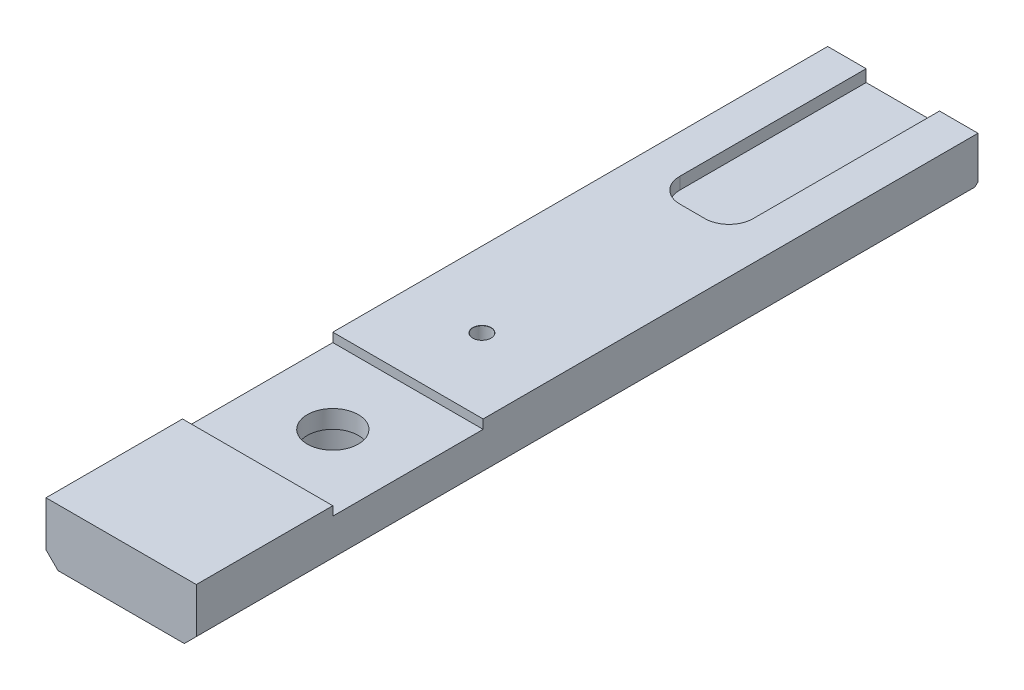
SolidWorks part; units mm, degrees
ref_plane "Plan1" through (0, 0, 0) normal (0, 0, 1) x (1, 0, 0)
ref_plane "Plan2" through (0, 0, 0) normal (0, 1, 0) x (1, 0, 0)
ref_plane "Plan3" through (0, 0, 0) normal (1, 0, 0) x (0, 0, -1)
sketch "Esquisse1" plane through (0, 0, 0) normal (0, 0, 1) x (1, 0, 0)
  line L0 (-12.5, 0) -> (-6.1, 0)
  line L1 (-6.1, 0) -> (-6.1, 1.5)
  line L2 (-6.1, 1.5) -> (6.1, 1.5)
  line L3 (6.1, 1.5) -> (6.1, 0)
  line L4 (6.1, 0) -> (12.5, 0)
  line L5 (-12.5, 0) -> (-12.5, 11.5)
  line L6 (-12.5, 11.5) -> (12.5, 11.5)
  line L7 (12.5, 11.5) -> (12.5, 0)
  line L8 (0, 21.0228) -> (0, -6.5728) construction
  dimension "D1" = 12.2
  dimension "D4" = 25
  dimension "D5" = 1.5
  dimension "D6" = 11.5
extrude "Base-Extrusion" add sketch "Esquisse1" along normal blind 130
chamfer "Chanfrein1" distance 0.5 angle 45 2 edges at (-6.1, 0, 65) (6.1, 0, 65)
sketch "Esquisse2" plane through (12.5, 0, 0) normal (1, 0, 0) x (0, 0, -1)
  line L0 (-130, 2) -> (-128, 0)
  line L1 (0, 4.5) -> (-4.5, 0)
  line L2 (-130, 0) -> (0, 0) construction
  line L3 (-130, 0) -> (-128, 0)
  line L4 (0, 0) -> (0, 11.5) construction
  line L5 (0, 0) -> (0, 4.5)
  line L6 (-130, 0) -> (-130, 11.5) construction
  line L7 (-130, 0) -> (-130, 2)
  line L8 (-4.5, 0) -> (0, 0)
  line L9 (-130, 11.5) -> (0, 11.5) construction
  line L10 (-107.3, 11.5) -> (-82.3, 11.5)
  line L11 (-107.3, 11.5) -> (-107.3, 10)
  line L12 (-107.3, 10) -> (-82.3, 10)
  line L13 (-82.3, 10) -> (-82.3, 11.5)
  line L14 (-94.8, 21.0588) -> (-94.8, 4.5) construction
  dimension "D1" = 4.5
  dimension "D2" = 2
  dimension "D3" = 2
  dimension "D4" = 25
  dimension "D5" = 1.5
  dimension "D6" = 35.2
extrude "Enlèv. mat.-Extru.1" cut sketch "Esquisse2" against normal through all
sketch "Esquisse5" plane through (0, 10, 0) normal (0, 1, 0) x (-1, 0, 0)
  line L0 (12.5, 107.3) -> (-12.5, 82.3) construction
  line L1 (-12.5, 130) -> (12.5, 130) construction
  line L2 (0, 130) -> (0, 58.7426) construction
  circle A0 centre (0, 94.8) radius 4.25
  dimension "D1" = 8.5
extrude "Enlèv. mat.-Extru.2" cut sketch "Esquisse5" against normal through all
sketch "Esquisse6" plane through (0, 1.5, 0) normal (0, -1, 0) x (1, 0, 0)
  circle A0 centre (0, 94.8) radius 7
  circle A1 centre (0, 94.8) radius 4.25 construction
  dimension "D1" = 14
extrude "Enlèv. mat.-Extru.3" cut sketch "Esquisse6" against normal blind 5.5 and the other way blind 140
chamfer "Chanfrein2" distance 4 angle 45 2 edges at (12.5, 0, 66.25) (-12.5, 0, 66.25)
hole_wizard "Diamètre du perçage Ø3.0 (3)1" positions "Esquisse7" profile "Esquisse8" hole size "Ø3.0" standard "ISO"
sketch "Esquisse7" plane through (0, 11.5, 0) normal (0, 1, 0) x (1, 0, 0)
  line L0 (0, -94.8) -> (0, -70) construction
  line L2 (12.5, -130) -> (-12.5, -130) construction
  point P0 (0, -70)
  dimension "D1" = 60
sketch "Esquisse8" plane through (0, 11.5, 70) normal (1, 0, 0) x (0, 0, 1)
  line L0 (0, 0) -> (0, 11.5)
  line L1 (0, 11.5) -> (1.5, 11.5)
  line L2 (1.5, 11.5) -> (1.5, 0.025)
  line L3 (1.5, 0.025) -> (1.525, 0)
  line L5 (1.525, 0) -> (0, 0)
  line L6 (-1.5, 0.025) -> (-1.525, 0) construction
  line L11 (0, -6.35) -> (0, 107.95) construction
  dimension "Diamètre du perçage jusqu'au prochain" = 3
  dimension "Profondeur du perçage jusqu'au prochain" = 11.5
  dimension "Diamètre du fraisage entrant" = 3.05
  dimension "Angle du fraisage entrant" = 90
sketch "Esquisse9" plane through (0, 0, 0) normal (0, 0, -1) x (-1, 0, 0)
  line L0 (-12.5, 11.5) -> (12.5, 11.5) construction
  line L1 (-6.1, 11.5) -> (6.1, 11.5)
  line L2 (-6.1, 11.5) -> (-6.1, 9.5)
  line L3 (-6.1, 9.5) -> (6.1, 9.5)
  line L4 (6.1, 11.5) -> (6.1, 9.5)
  line L5 (0, 0) -> (0, 9.5) construction
  dimension "D1" = 12.2
  dimension "D2" = 2
extrude "Enlèv. mat.-Extru.4" cut sketch "Esquisse9" against normal blind 35
fillet "Congé1" radius 4 2 edges at (6.1, 10.5, 35) (-6.1, 10.5, 35)
chamfer "Chanfrein3" distance 0.8 angle 45 1 edges at (-1.5, 1.5, 70)
